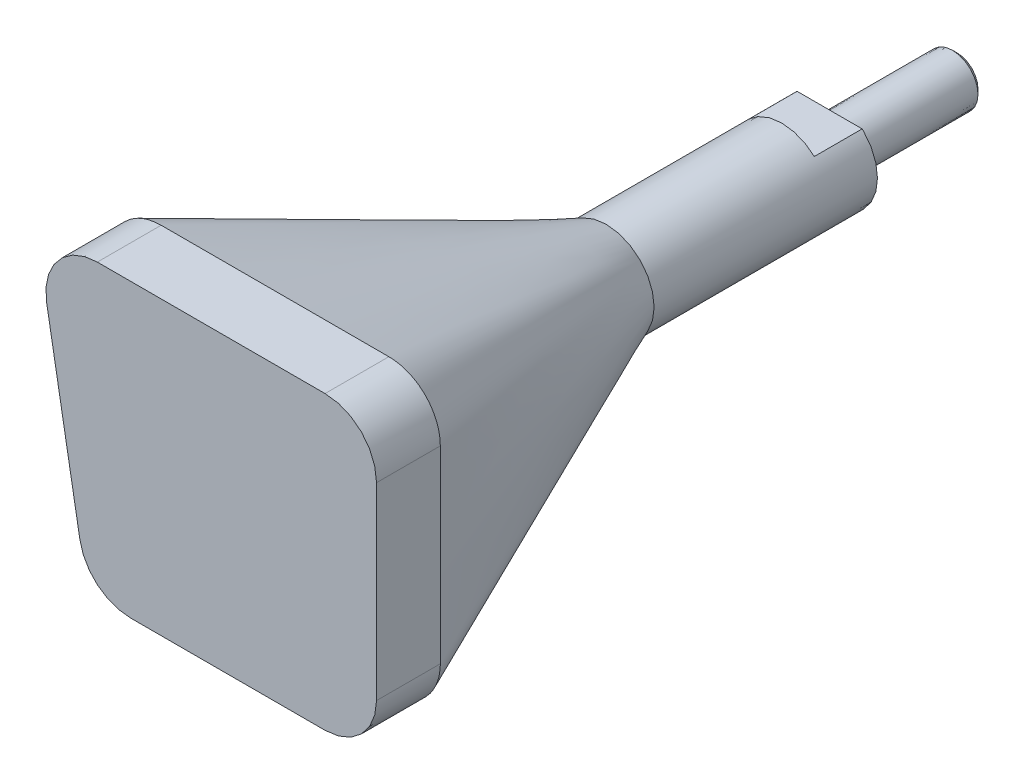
SolidWorks part; units mm, degrees
ref_plane "Plan de face" through (0, 0, 0) normal (0, 0, 1) x (1, 0, 0)
ref_plane "Plan de dessus" through (0, 0, 0) normal (0, 1, 0) x (1, 0, 0)
ref_plane "Plan de droite" through (0, 0, 0) normal (1, 0, 0) x (0, 0, -1)
sketch "Esquisse1" plane through (0, 0, 0) normal (0, 0, 1) x (1, 0, 0)
  line L0 (206.0697, -130.7641) -> (134.7029, -130.7641) construction
  line L1 (118.8189, -149.6939) -> (129.2469, -208.8337) construction
  line L2 (145.1309, -222.162) -> (206.0697, -222.162) construction
  line L3 (222.1987, -206.0329) -> (222.1987, -146.8932) construction
  line L4 (206.0697, -130.7641) -> (134.7029, -130.7641)
  line L5 (118.8189, -149.6939) -> (129.2469, -208.8337)
  line L6 (145.1309, -222.162) -> (206.0697, -222.162)
  line L7 (222.1987, -206.0329) -> (222.1987, -146.8932)
  arc A0 (134.7029, -130.7641) -> (118.8189, -149.6939) centre (134.7029, -146.8932) ccw construction
  arc A1 (129.2469, -208.8337) -> (145.1309, -222.162) centre (145.1309, -206.0329) ccw construction
  arc A2 (206.0697, -222.162) -> (222.1987, -206.0329) centre (206.0697, -206.0329) ccw construction
  arc A3 (222.1987, -146.8932) -> (206.0697, -130.7641) centre (206.0697, -146.8932) ccw construction
  arc A4 (134.7029, -130.7641) -> (118.8189, -149.6939) centre (134.7029, -146.8932) ccw
  arc A5 (129.2469, -208.8337) -> (145.1309, -222.162) centre (145.1309, -206.0329) ccw
  arc A6 (206.0697, -222.162) -> (222.1987, -206.0329) centre (206.0697, -206.0329) ccw
  arc A7 (222.1987, -146.8932) -> (206.0697, -130.7641) centre (206.0697, -146.8932) ccw
extrude "Boss.-Extru.1" add sketch "Esquisse1" along normal blind 20
sketch "Esquisse2" plane through (0, 0, 0) normal (0, 0, -1) x (-1, 0, 0)
  line L4 (-222.1987, -146.8932) -> (-222.1987, -206.0329)
  line L5 (-206.0697, -222.162) -> (-145.1309, -222.162)
  line L6 (-129.2469, -208.8337) -> (-118.8189, -149.6939)
  line L7 (-134.7029, -130.7641) -> (-206.0697, -130.7641)
  line L8 (-222.1987, -146.8932) -> (-222.1987, -206.0329)
  line L9 (-206.0697, -222.162) -> (-145.1309, -222.162)
  line L10 (-129.2469, -208.8337) -> (-118.8189, -149.6939)
  line L11 (-134.7029, -130.7641) -> (-206.0697, -130.7641)
  arc A4 (-206.0697, -130.7641) -> (-222.1987, -146.8932) centre (-206.0697, -146.8932) ccw
  arc A5 (-222.1987, -206.0329) -> (-206.0697, -222.162) centre (-206.0697, -206.0329) ccw
  arc A6 (-145.1309, -222.162) -> (-129.2469, -208.8337) centre (-145.1309, -206.0329) ccw
  arc A7 (-118.8189, -149.6939) -> (-134.7029, -130.7641) centre (-134.7029, -146.8932) ccw
  arc A8 (-206.0697, -130.7641) -> (-222.1987, -146.8932) centre (-206.0697, -146.8932) ccw
  arc A9 (-222.1987, -206.0329) -> (-206.0697, -222.162) centre (-206.0697, -206.0329) ccw
  arc A10 (-145.1309, -222.162) -> (-129.2469, -208.8337) centre (-145.1309, -206.0329) ccw
  arc A11 (-118.8189, -149.6939) -> (-134.7029, -130.7641) centre (-134.7029, -146.8932) ccw
  dimension "D1" = 0
ref_plane "Plan1" through (0, 0, -100) normal (0, 0, -1) x (-1, 0, 0)
sketch "Esquisse3" plane through (0, 0, -100) normal (0, 0, -1) x (-1, 0, 0)
  line L0 (-134.7029, -130.7641) -> (-206.0697, -130.7641) construction
  line L1 (-222.1987, -146.8932) -> (-222.1987, -206.0329) construction
  circle A0 centre (-174.1987, -175.7641) radius 15
  dimension "D1" = 30
  dimension "D2" = 45
  dimension "D3" = 48
loft "Lissage1" add profiles "Esquisse2", "Esquisse3"
sketch "Esquisse4" plane through (0, 0, -100) normal (0, 0, -1) x (-1, 0, 0)
  circle A1 centre (-174.1987, -175.7641) radius 15
  circle A2 centre (-174.1987, -175.7641) radius 15
  dimension "D1" = 0
extrude "Boss.-Extru.2" add sketch "Esquisse4" along normal blind 70
sketch "Esquisse5" plane through (0, 0, -170) normal (0, 0, -1) x (-1, 0, 0)
  line L1 (-191.7906, -195.4043) -> (-191.7906, -186.7641)
  line L2 (-191.7906, -195.4043) -> (-158.0015, -195.4043)
  line L3 (-158.0015, -195.4043) -> (-158.0015, -186.7641)
  line L4 (-191.7906, -186.7641) -> (-158.0015, -186.7641)
  line L5 (-191.7906, -164.7641) -> (-191.7906, -157.5126)
  line L6 (-191.7906, -164.7641) -> (-156.7672, -164.7641)
  line L7 (-156.7672, -164.7641) -> (-156.7672, -157.5126)
  line L8 (-191.7906, -157.5126) -> (-156.7672, -157.5126)
  circle A0 centre (-174.1987, -175.7641) radius 15 construction
  dimension "D1" = 11
  dimension "D2" = 11
extrude "Enlèv. mat.-Extru.1" cut sketch "Esquisse5" against normal blind 15
sketch "Esquisse6" plane through (0, 0, -170) normal (0, 0, -1) x (-1, 0, 0)
  circle A0 centre (-174.1987, -175.7641) radius 8
  arc A1 (-184.3968, -164.7641) -> (-184.3968, -186.7641) centre (-174.1987, -175.7641) ccw construction
  dimension "D1" = 16
extrude "Boss.-Extru.3" add sketch "Esquisse6" along normal blind 40
chamfer "Chanfrein1" distance 1.5 angle 45 1 edges at (166.1987, -175.7641, -210)
